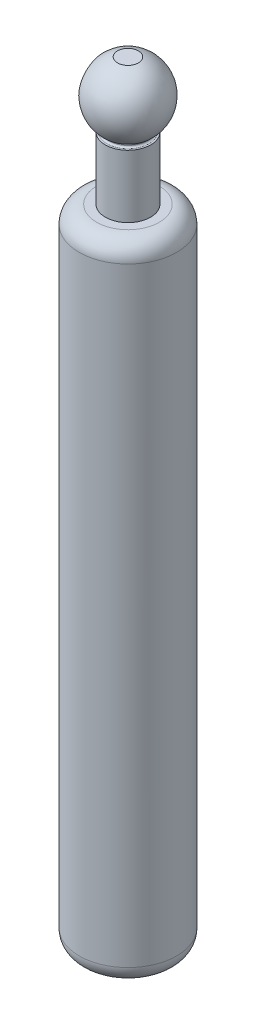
SolidWorks part; units mm, degrees
ref_plane "Face" through (0, 0, 0) normal (0, 0, 1) x (1, 0, 0)
ref_plane "Dessus" through (0, 0, 0) normal (0, 1, 0) x (1, 0, 0)
ref_plane "Droite" through (0, 0, 0) normal (1, 0, 0) x (0, 0, -1)
sketch "Esquisse1" plane through (0, 0, 0) normal (0, 0, 1) x (1, 0, 0)
  line L0 (0, 88.2813) -> (0, -88.2813) construction
  line L1 (0, 9.5394) -> (3, 9.5394)
  line L2 (6.5, -27.0993) -> (14, -27.0993)
  line L3 (14, -27.0993) -> (14, -212.0993)
  line L4 (14, -212.0993) -> (7, -212.0993)
  line L5 (0, -52.0993) -> (0, 9.5394)
  line L6 (6.5, -7.5993) -> (5.5, -7.5993)
  line L7 (6.5, -9.0993) -> (6.5, -27.0993)
  line L8 (6.5, -9.0993) -> (5.5, -9.0993)
  line L9 (5.5, -7.5993) -> (5.5, -9.0993)
  line L10 (0, -52.0993) -> (7, -52.0993)
  line L11 (7, -52.0993) -> (7, -212.0993)
  arc A0 (6.5, -7.5993) -> (3, 9.5394) centre (0, 0) ccw
  dimension "D1" = 10
  dimension "D2" = 6.5
  dimension "D3" = 14
  dimension "D4" = 185
  dimension "D5" = 18
  dimension "D6" = 1.5
  dimension "D7" = 1
  dimension "D8" = 3
  dimension "D9" = 160
  dimension "D10" = 14
revolve "Base-Révolution" add sketch "Esquisse1" angle 360 about L0
fillet "Congé1" radius 0.5
sketch "Esquisse2" plane through (0, 0, 0) normal (0, 1, 0) x (1, 0, 0)
  line L1 (-12.2535, 9.8649) -> (-7, 9.8649)
  line L2 (-12.2535, 9.8649) -> (-12.2535, -10.4487)
  line L3 (-12.2535, -10.4487) -> (-7, -10.4487)
  line L4 (-7, 9.8649) -> (-7, -10.4487)
  dimension "D1" = 7
extrude "Enlèv. mat.-Extru.1" cut sketch "Esquisse2" against normal up to next and the other way up to next
sketch "Esquisse3" plane through (-7, 0, 0) normal (-1, 0, 0) x (0, 0, 1)
  circle A0 centre (0, 0) radius 6.5
  dimension "D1" = 13
extrude "Enlèv. mat.-Extru.2" cut sketch "Esquisse3" against normal blind 5
sketch "Esquisse4" plane through (0, 0, 0) normal (0, 1, 0) x (1, 0, 0)
  line L0 (-9.8991, 0) -> (13.9947, 0) construction
  line L1 (-2, 0) -> (-7, 0) construction
  line L2 (-6.5, 0) -> (6.5, 0)
  arc A0 (6.5, 0) -> (-6.5, 0) centre (0, 0) ccw
  dimension "D1" = 13
revolve "Enlèvement de matière-Révolution1" cut sketch "Esquisse4" angle 360 about L0
fillet "Congé2" radius 5
fillet "Congé3" radius 5
